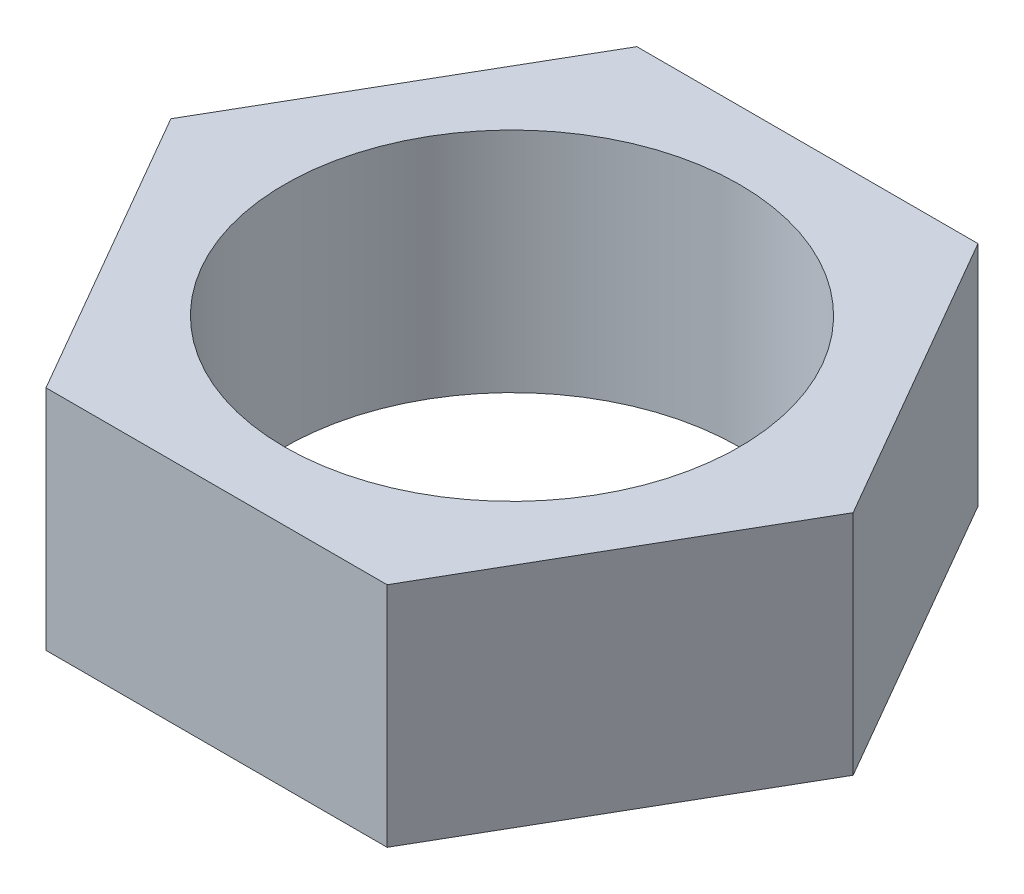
SolidWorks part; units mm, degrees
ref_plane "Front Plane" through (0, 0, 0) normal (0, 0, 1) x (1, 0, 0)
ref_plane "Top Plane" through (0, 0, 0) normal (0, 1, 0) x (1, 0, 0)
ref_plane "Right Plane" through (0, 0, 0) normal (1, 0, 0) x (0, 0, -1)
sketch "Sketch1" plane through (0, 0, 0) normal (0, 1, 0) x (1, 0, 0)
  line L1 (-3, 0) -> (-1.5, -2.5981)
  line L2 (-1.5, -2.5981) -> (1.5, -2.5981)
  line L3 (1.5, -2.5981) -> (3, 0)
  line L4 (3, 0) -> (1.5, 2.5981)
  line L5 (1.5, 2.5981) -> (-1.5, 2.5981)
  line L6 (-1.5, 2.5981) -> (-3, 0)
  circle A0 centre (0, 0) radius 2.5981 construction
  circle A1 centre (0, 0) radius 2
  dimension "D1" = 4
  dimension "D2" = 6
extrude "Boss-Extrude1" add sketch "Sketch1" along normal blind 2
